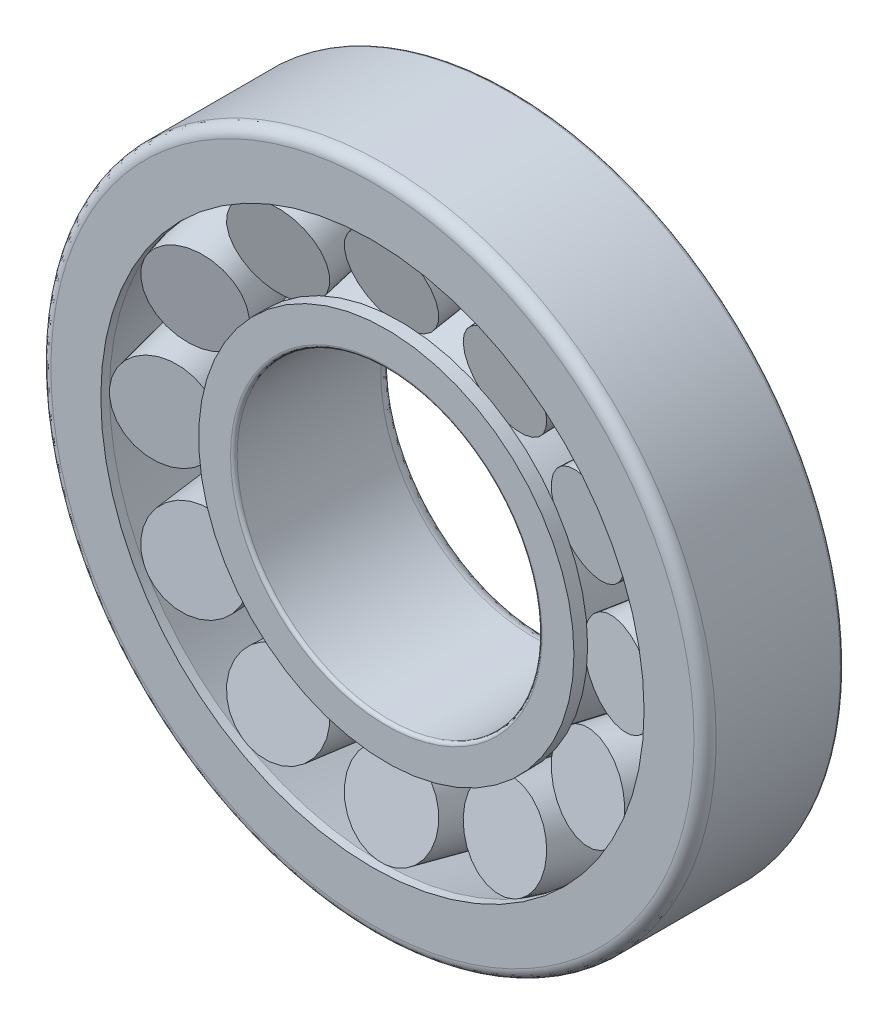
SolidWorks part; units mm, degrees
ref_plane "Front Plane" through (0, 0, 0) normal (0, 0, 1) x (1, 0, 0)
ref_plane "Top Plane" through (0, 0, 0) normal (0, 1, 0) x (1, 0, 0)
ref_plane "Right Plane" through (0, 0, 0) normal (1, 0, 0) x (0, 0, -1)
sketch "BaseSke" plane through (0, 0, 0) normal (1, 0, 0) x (0, 0, -1)
  line L0 (-47.2296, 0) -> (24.6132, 0) construction
  line L2 (0, 129.5214) -> (0, -86.3012) construction
  line L3 (4.5994, 48.448) -> (-36.0994, 39.052) construction
  line L4 (-31.5, 60) -> (-6.5, 60) construction
  line L5 (-29, 27.5) -> (0, 27.5) construction
  line L6 (-15.75, 43.75) -> (-21.8392, 70.1254) construction
  line L7 (-29.925, 49.0195) -> (-8.075, 54.6703)
  line L8 (-8.075, 54.6703) -> (-6.0698, 45.9848)
  line L9 (-6.0698, 45.9848) -> (-28.0527, 40.9097)
  line L10 (-28.0527, 40.9097) -> (-29.925, 49.0195)
  line L11 (-31.5, 60) -> (-31.5, 49) construction
  line L12 (-29.9205, 49) -> (-6.5, 55.057) construction
  line L13 (-6.5, 60) -> (-6.5, 55.057) construction
  line L14 (-29.9205, 49) -> (-31.5, 49) construction
  line L15 (-26.1804, 32.7999) -> (-4.0646, 37.2994) construction
  line L16 (-29, 27.5) -> (-29, 33.8499) construction
  line L17 (-29, 33.8499) -> (-26.5255, 33.8499) construction
  line L18 (0, 38.3494) -> (0, 27.5) construction
  line L19 (-26.5255, 33.8499) -> (-26.2897, 32.8287) construction
  line L20 (-26.2897, 32.8287) -> (-3.9778, 37.3681) construction
  line L21 (-3.9778, 37.3681) -> (-4.2044, 38.3494) construction
  line L22 (-4.2044, 38.3494) -> (0, 38.3494) construction
revolve "Roller" add sketch "BaseSke" angle 360 about L3
sketch "OuterRaceSke" plane through (0, 0, 0) normal (1, 0, 0) x (0, 0, -1)
  line L0 (-29.9205, 49) -> (-31.5, 49) construction
  line L1 (-29.9205, 49) -> (-6.5, 55.057) construction
  line L2 (-6.5, 60) -> (-6.5, 55.057) construction
  line L3 (-31.5, 60) -> (-6.5, 60) construction
  line L4 (-31.5, 60) -> (-31.5, 49) construction
  line L5 (-29.9205, 49) -> (-31.5, 49)
  line L6 (-29.9205, 49) -> (-6.5, 55.057)
  line L7 (-6.5, 60) -> (-6.5, 55.057)
  line L8 (-31.5, 60) -> (-6.5, 60)
  line L9 (-31.5, 60) -> (-31.5, 49)
  line L10 (-60.3939, 0) -> (35.9926, 0) construction
revolve "OuterRace" add sketch "OuterRaceSke" angle 360 about L10
sketch "InnerRaceSke" plane through (0, 0, 0) normal (1, 0, 0) x (0, 0, -1)
  line L0 (-29, 27.5) -> (0, 27.5) construction
  line L1 (-29, 27.5) -> (-29, 33.8499) construction
  line L2 (-29, 33.8499) -> (-26.5255, 33.8499) construction
  line L3 (-26.5255, 33.8499) -> (-26.2897, 32.8287) construction
  line L4 (-26.2897, 32.8287) -> (-3.9778, 37.3681) construction
  line L5 (-3.9778, 37.3681) -> (-4.2044, 38.3494) construction
  line L6 (-4.2044, 38.3494) -> (0, 38.3494) construction
  line L7 (0, 38.3494) -> (0, 27.5) construction
  line L8 (-29, 27.5) -> (0, 27.5)
  line L9 (-29, 27.5) -> (-29, 33.8499)
  line L10 (-29, 33.8499) -> (-26.5255, 33.8499)
  line L11 (-26.5255, 33.8499) -> (-26.2897, 32.8287)
  line L12 (-26.2897, 32.8287) -> (-3.9778, 37.3681)
  line L13 (-3.9778, 37.3681) -> (-4.2044, 38.3494)
  line L14 (-4.2044, 38.3494) -> (0, 38.3494)
  line L15 (0, 38.3494) -> (0, 27.5)
  line L16 (-58.1022, 0) -> (39.538, 0) construction
revolve "InnerRace" add sketch "InnerRaceSke" angle 360 about L16
fillet "Fillet1" radius 0.6 2 edges at (60, 0, 6.5) (27.5, 0, 29)
fillet "InnerFillet" radius 2.5 1 edges at (27.5, 0, 0)
fillet "OuterFillet" radius 2 1 edges at (60, 0, 31.5)
pattern_circular "CirPatternBall" count 12 over 360 about axis through (0, 0, 0) along (0, 0, 1) of "Roller"
sketch "Sketch4" plane through (0, 0, 0) normal (1, 0, 0) x (0, 0, -1)
  line L0 (-29.925, 49.0195) -> (-8.075, 54.6703)
  line L1 (-8.075, 54.6703) -> (-4.0646, 37.2994)
  line L2 (-4.0646, 37.2994) -> (-26.1804, 32.7999)
  line L3 (-26.1804, 32.7999) -> (-29.925, 49.0195)
  line L4 (-40.3293, 0) -> (19.5574, 0) construction
revolve "Simplified" [suppressed] add sketch "Sketch4" angle 360 about L4
equation "\"D2@BaseSke\" = \"Bearing_Thickness@BaseSke\"/2"
equation "\"D3@BaseSke\" =  ( \"Bearing_Outside_Diameter@BaseSke\" + \"Bearing_Inside_Diameter@BaseSke\" )  / 2"
equation "\"Roller_diameter@BaseSke\" = \"D3@BaseSke\"*1.12"
equation "\"D4@BaseSke\" = \"Bearing_Thickness@BaseSke\"/20"
equation "\"D5@BaseSke\" = \"Bearing_Thickness@BaseSke\" / 20"
equation "\"D8@BaseSke\" = \"Bearing_Thickness@BaseSke\"/30"
equation "\"D11@BaseSke\" = \"D8@BaseSke\""
equation "\"D1@CirPatternBall\" = int(  \"D3@BaseSke\" *  pi  /  ( \"Bearing_Outside_Diameter@BaseSke\" - \"Bearing_Inside_Diameter@BaseSke\" )  * 3 ) "
